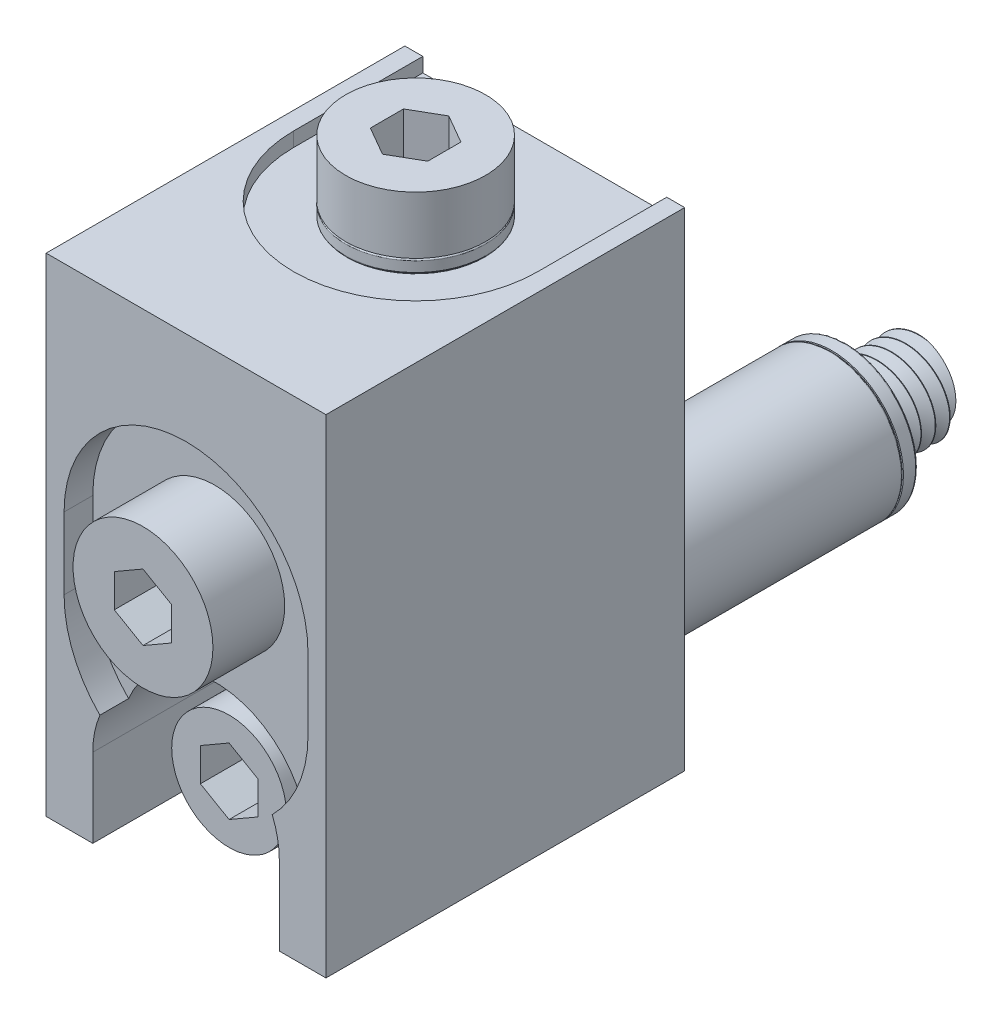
SolidWorks part; units mm, degrees
other "Camera2"
ref_plane "Front Plane" through (0, 0, 0) normal (0, 0, 1) x (1, 0, 0)
ref_plane "Top Plane" through (0, 0, 0) normal (0, 1, 0) x (1, 0, 0)
ref_plane "Right Plane" through (0, 0, 0) normal (1, 0, 0) x (0, 0, -1)
imported_body "Imported3"
sketch "Sketch1" plane through (18.25, 0, 0) normal (1, 0, 0) x (0, 0, -1)
  line L0 (-25, 34) -> (0, 34)
  line L1 (0, 34) -> (0, 0)
  line L2 (0, 0) -> (-25, 0)
  line L3 (-25, 0) -> (-25, 34)
  line L4 (-9, 34) -> (-25, 34) construction
  line L5 (-25, 0) -> (-25, 34) construction
  dimension "D1" = 25
  dimension "D2" = 34
extrude "Boss-Extrude1" add sketch "Sketch1" along normal blind 1.25
sketch "Sketch2" plane through (1.25, 0, 0) normal (-1, 0, 0) x (0, 0, 1)
  line L0 (25, 0) -> (0, 0)
  line L1 (0, 0) -> (0, 34)
  line L2 (0, 34) -> (25, 34)
  line L3 (25, 34) -> (25, 0)
  line L4 (0, 0) -> (0, 33) construction
  line L5 (25, 0) -> (0, 0) construction
  dimension "D1" = 25
  dimension "D2" = 34
extrude "Boss-Extrude2" add sketch "Sketch2" along normal blind 1.25
ref_plane "Plane1" through (0, 34, 0) normal (0, -1, 0) x (1, 0, 0)
sketch "Sketch3" plane through (0, 34, 0) normal (0, -1, 0) x (1, 0, 0)
  circle A0 centre (9.75, 9) radius 4.875
  dimension "D1" = 9.75
extrude "Boss-Extrude3" add sketch "Sketch3" against normal blind 4
sketch "Sketch4" plane through (0, 0, 25) normal (0, 0, 1) x (1, 0, 0)
  line L0 (16.25, 0) -> (16.25, 5.5)
  line L1 (3.25, 5.5) -> (3.25, 0)
  line L2 (3.25, 0) -> (16.25, 0)
  line L3 (19.5, 34) -> (19.5, 0) construction
  line L4 (0, 0) -> (19.5, 0) construction
  arc A0 (16.25, 5.5) -> (3.25, 5.5) centre (9.75, 5.5) ccw
  dimension "D1" = 6.5
  dimension "D2" = 9.75
  dimension "D3" = 5.5
extrude "Cut-Extrude1" cut sketch "Sketch4" against normal blind 2
sketch "Sketch5" plane through (0, 0, 25) normal (0, 0, 1) x (1, 0, 0)
  line L0 (1.25, 19) -> (1.25, 14)
  line L1 (18.25, 14) -> (18.25, 19)
  line L2 (16.25, 0) -> (16.25, 5.5) construction
  line L3 (0, 0) -> (3.25, 0) construction
  arc A0 (1.25, 14) -> (3.7439, 7.9853) centre (9.75, 14) ccw
  arc A1 (3.7439, 7.9853) -> (15.7561, 7.9853) centre (9.75, 5.5) cw
  arc A2 (15.7561, 7.9853) -> (18.25, 14) centre (9.75, 14) ccw
  arc A3 (18.25, 19) -> (1.25, 19) centre (9.75, 19) ccw
  dimension "D1" = 8.5
  dimension "D2" = 6.5
  dimension "D3" = 0.4939
  dimension "D4" = 6.5
  dimension "D5" = 5.5
  dimension "D8" = 19
extrude "Cut-Extrude2" cut sketch "Sketch5" against normal blind 2
ref_plane "Plane2" through (0, 0, 23) normal (0, 0, 1) x (1, 0, 0)
ref_plane "Plane3" through (0, 0, 15) normal (0, 0, -1) x (-1, 0, 0)
sketch "Sketch7" plane through (0, 0, 15) normal (0, 0, -1) x (-1, 0, 0)
  line L0 (-16.25, 0) -> (-3.25, 0)
  line L1 (-3.25, 0) -> (-3.25, 5.5)
  line L2 (-16.25, 5.5) -> (-16.25, 0)
  arc A0 (-3.25, 5.5) -> (-16.25, 5.5) centre (-9.75, 5.5) ccw
  dimension "D1" = 6.5
  dimension "D2" = 5.5
extrude "Cut-Extrude3" cut sketch "Sketch7" against normal up to surface
sketch "Sketch8" plane through (0, 0, 23) normal (0, 0, 1) x (1, 0, 0)
  line L0 (18.25, 14) -> (18.25, 19) construction
  circle A0 centre (9.75, 19) radius 4.875
  dimension "D1" = 9.75
  dimension "D2" = 8.5
extrude "Boss-Extrude4" add sketch "Sketch8" along normal blind 5
sketch "Sketch9" plane through (0, 0, 28) normal (0, 0, 1) x (1, 0, 0)
  line L0 (11.75, 20.1547) -> (9.75, 21.3094)
  line L1 (9.75, 21.3094) -> (7.75, 20.1547)
  line L2 (7.75, 20.1547) -> (7.75, 17.8453)
  line L3 (7.75, 17.8453) -> (9.75, 16.6906)
  line L4 (9.75, 16.6906) -> (11.75, 17.8453)
  line L5 (11.75, 17.8453) -> (11.75, 20.1547)
  circle A0 centre (9.75, 19) radius 4.875 construction
  dimension "D1" = 2
  dimension "D2" = 2
  dimension "D3" = 1.1547
  dimension "D4" = 2.3094
  dimension "D5" = 1.1547
  dimension "D6" = 2.3094
extrude "Cut-Extrude4" cut sketch "Sketch9" against normal blind 3
sketch "Sketch10" plane through (0, 0, 15) normal (0, 0, 1) x (1, 0, 0)
  line L0 (16.25, 5.5) -> (16.25, 0) construction
  circle A0 centre (9.75, 5.5) radius 4
  dimension "D1" = 8
  dimension "D2" = 6.5
  dimension "D3" = 5.5
extrude "Boss-Extrude5" add sketch "Sketch10" along normal blind 7
sketch "Sketch11" plane through (0, 0, 22) normal (0, 0, 1) x (1, 0, 0)
  line L0 (11.75, 6.6547) -> (9.75, 7.8094)
  line L1 (9.75, 7.8094) -> (7.75, 6.6547)
  line L2 (7.75, 6.6547) -> (7.75, 4.3453)
  line L3 (7.75, 4.3453) -> (9.75, 3.1906)
  line L4 (9.75, 3.1906) -> (11.75, 4.3453)
  line L5 (11.75, 4.3453) -> (11.75, 6.6547)
  circle A0 centre (9.75, 5.5) radius 4 construction
  dimension "D1" = 2
  dimension "D2" = 2
  dimension "D3" = 1.1547
  dimension "D4" = 2.3094
  dimension "D5" = 1.1547
  dimension "D6" = 2.3094
extrude "Cut-Extrude5" cut sketch "Sketch11" against normal blind 5
sketch "Sketch12" plane through (0, 38, 0) normal (0, 1, 0) x (-1, 0, 0)
  line L0 (-11.75, 7.8453) -> (-9.75, 6.6906)
  line L1 (-9.75, 6.6906) -> (-7.75, 7.8453)
  line L2 (-7.75, 7.8453) -> (-7.75, 10.1547)
  line L3 (-7.75, 10.1547) -> (-9.75, 11.3094)
  line L4 (-9.75, 11.3094) -> (-11.75, 10.1547)
  line L5 (-11.75, 10.1547) -> (-11.75, 7.8453)
  circle A0 centre (-9.75, 9) radius 4.875 construction
  dimension "D1" = 2
  dimension "D2" = 2
  dimension "D3" = 1.1547
  dimension "D4" = 2.3094
  dimension "D5" = 1.1547
  dimension "D6" = 2.3094
extrude "Cut-Extrude6" cut sketch "Sketch12" against normal blind 3
hole_wizard "Ø2.0 (2) Diameter Hole1" positions "Sketch14" profile "Sketch13" hole size "Ø2.0" standard "ANSI Metric"
sketch "Sketch14" plane through (0, 0, -26) normal (0, 0, -1) x (-1, 0, 0)
  point P0 (-9.75, 5.5)
sketch "Sketch13" plane through (9.75, 5.5, -26) normal (1, 0, 0) x (0, 1, 0)
  line L0 (0, 0) -> (0, 26)
  line L1 (0, 26) -> (1, 26)
  line L2 (1, 26) -> (1, 0)
  line L5 (1, 0) -> (0, 0)
  line L10 (0, 26) -> (-1, 26) construction
  line L11 (0, -6.35) -> (0, 107.95) construction
  dimension "Hole Dia." = 2
  dimension "Hole Depth" = 26
  dimension "Drill Angle" = 180
fillet "Fillet1" radius 0.099 6 edges at (9.75, 33.95, 4.125) (14.75, 5.5, -19.95) (14.65, 5.5, 0) (4.75, 5.5, -20.95) (9.75, 33.05, 13.875) (4.75, 5.5, -1)
